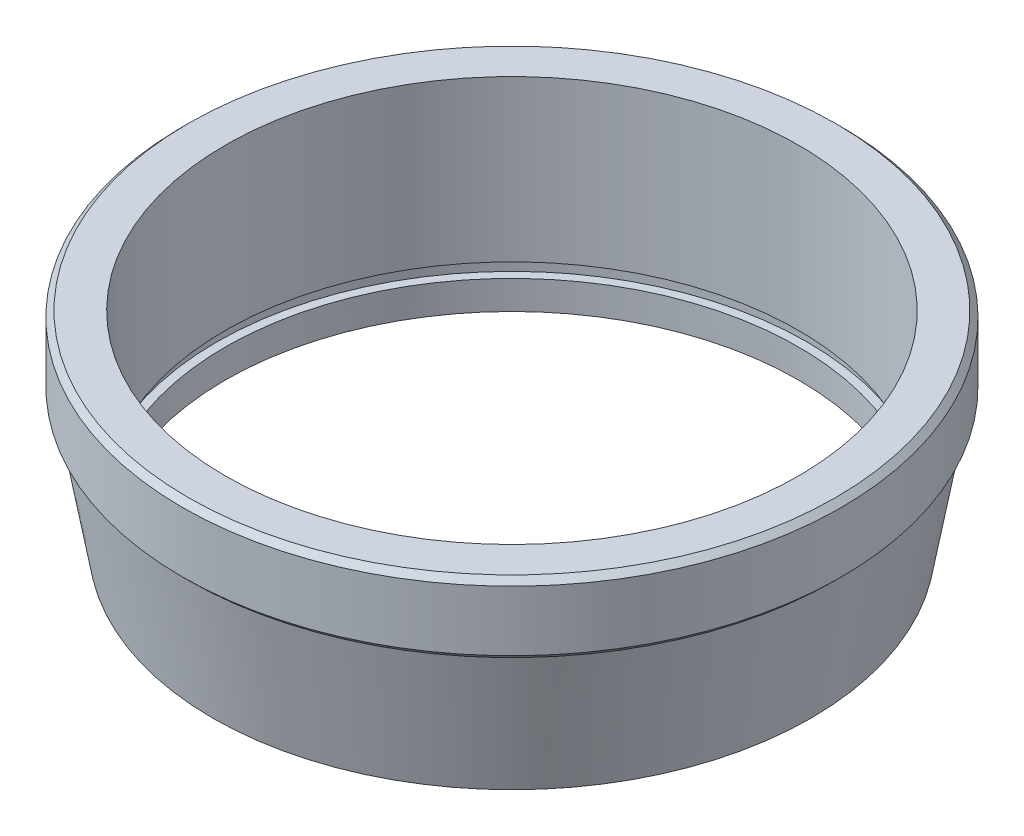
SolidWorks part; units mm, degrees
ref_plane "Přední rovina" through (0, 0, 0) normal (0, 0, 1) x (1, 0, 0)
ref_plane "Horní rovina" through (0, 0, 0) normal (0, 1, 0) x (1, 0, 0)
ref_plane "Pravá rovina" through (0, 0, 0) normal (1, 0, 0) x (0, 0, -1)
sketch "Skica1" plane through (0, 0, 0) normal (0, 1, 0) x (1, 0, 0)
  circle A0 centre (0, 0) radius 11.25
extrude "Přidat vysunutím1" add sketch "Skica1" against normal blind 4.6 draft 10
sketch "Skica2" plane through (0, 0, 0) normal (0, 1, 0) x (-1, 0, 0)
  circle A0 centre (0, 0) radius 11.5
extrude "Přidat vysunutím2" add sketch "Skica2" along normal blind 2.5
chamfer "Zkosení1" distance 0.2 angle 45 2 edges at (0, 0, 11.5) (0, 2.5, 11.5)
sketch "Skica3" plane through (0, 2.5, 0) normal (0, 1, 0) x (1, 0, 0)
  circle A0 centre (0, 0) radius 10
extrude "Odebrat vysunutím1" cut sketch "Skica3" against normal blind 2.5
sketch "Skica4" plane through (0, -4.6, 0) normal (0, -1, 0) x (1, 0, 0)
  circle A0 centre (0, 0) radius 10
extrude "Odebrat vysunutím2" cut sketch "Skica4" against normal up to surface (4.6 mm away)
sketch "Skica5" plane through (0, 0, 0) normal (0, 0, 1) x (1, 0, 0)
  line L0 (-10.4389, -4.6) -> (10.4389, -4.6) construction
  line L1 (-10.3, -3.6) -> (-10, -3.6)
  line L2 (-10.3, -3.6) -> (-10.3, -3.1)
  line L3 (-10.3, -3.1) -> (-10, -3.1)
  line L4 (-10, -3.6) -> (-10, -3.1)
  line L5 (-10, -4.6) -> (10, -4.6) construction
  point P8 (-3.25, -4.6)
  dimension "D1" = 0.3
  dimension "D2" = 0.5
  dimension "D3" = 1
  dimension "D5" = 10.3
ref_axis "Osa1" through (0, 2.5, 0) along (0, -1, 0)
revolve "Odebrat rotací1" cut sketch "Skica5" angle 360 about axis through (0, 2.5, 0) along (0, -1, 0)
